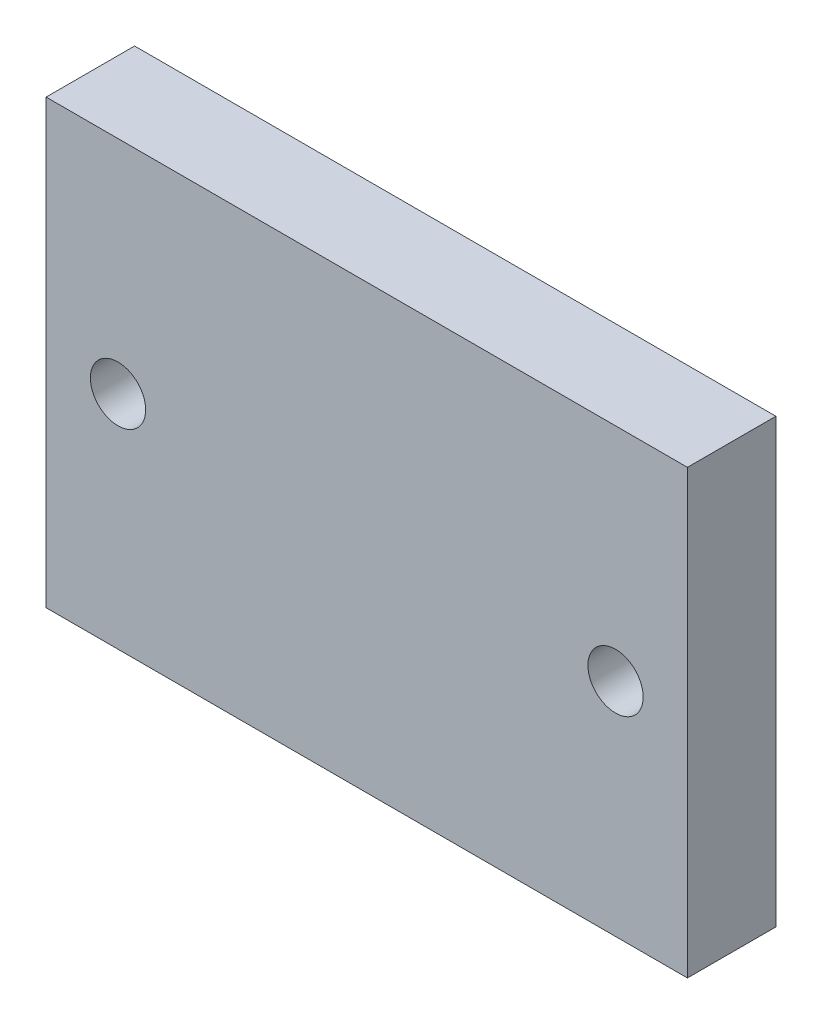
SolidWorks part; units mm, degrees
ref_plane "Plan de face" through (0, 0, 0) normal (0, 0, 1) x (1, 0, 0)
ref_plane "Plan de dessus" through (0, 0, 0) normal (0, 1, 0) x (1, 0, 0)
ref_plane "Plan de droite" through (0, 0, 0) normal (1, 0, 0) x (0, 0, -1)
sketch "Esquisse1" plane through (0, 0, 0) normal (0, 0, 1) x (1, 0, 0)
  line L0 (0, 39.6653) -> (0, -39.3306) construction
  line L1 (34.5755, 0) -> (-37.0565, 0) construction
  line L3 (-29, 20) -> (29, 20)
  line L4 (-29, 20) -> (-29, -20)
  line L5 (-29, -20) -> (29, -20)
  line L6 (29, 20) -> (29, -20)
  dimension "D1" = 40
  dimension "D2" = 58
extrude "Extrusion1" add sketch "Esquisse1" along normal blind 8
hole_wizard "Trou taraudé M61" positions "Esquisse5" profile "Esquisse4" tap size "M6" standard "ISO"
sketch "Esquisse5" plane through (0, 0, 0) normal (0, 0, -1) x (-1, 0, 0)
  line L0 (0, 17.3476) -> (0, -11.4921) construction
  line L2 (-25.2728, 0) -> (18.5225, 0) construction
  point P0 (-22.5, 0)
  point P14 (22.5, 0)
  dimension "D1" = 22.5
sketch "Esquisse4" plane through (22.5, 0, 0) normal (1, 0, 0) x (0, 1, 0)
  line L0 (0, 0) -> (0, 18.5022)
  line L1 (0, 18.5022) -> (2.5, 17)
  line L2 (2.5, 17) -> (2.5, 0)
  line L5 (2.5, 0) -> (0, 0)
  line L10 (0, 18.5022) -> (-2.5, 17) construction
  line L11 (0, -6.35) -> (0, 107.95) construction
  dimension "Diamètre du trou pour taraudage" = 5
  dimension "Profondeur du trou pour taraudage" = 17
  dimension "Angle de pointe" = 118
